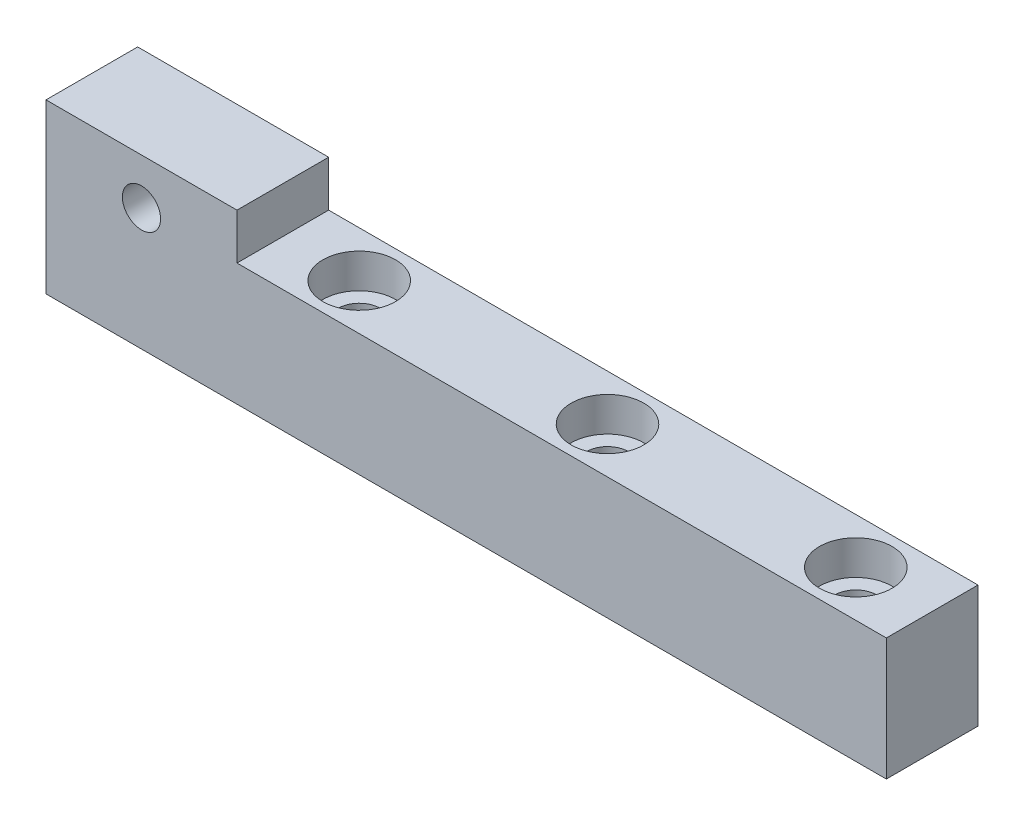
SolidWorks part; units mm, degrees
ref_plane "前视基准面" through (0, 0, 0) normal (0, 0, 1) x (1, 0, 0)
ref_plane "上视基准面" through (0, 0, 0) normal (0, 1, 0) x (1, 0, 0)
ref_plane "右视基准面" through (0, 0, 0) normal (1, 0, 0) x (0, 0, -1)
sketch "草图1" plane through (0, 0, 0) normal (0, 0, 1) x (1, 0, 0)
  line L0 (110, 0) -> (110, 16)
  line L1 (0, 0) -> (0, 22)
  line L2 (25, 16) -> (110, 16)
  line L3 (0, 0) -> (110, 0)
  line L4 (25, 16) -> (25, 22)
  line L5 (0, 22) -> (25, 22)
  circle A0 centre (12.5, 16) radius 2.5
extrude "凸台-拉伸1" add sketch "草图1" along normal blind 12
sketch "草图2" plane through (0, 16, 0) normal (0, 1, 0) x (1, 0, 0)
  circle A0 centre (100, -6) radius 2.75
  circle A1 centre (67.5, -6) radius 2.75
  circle A2 centre (35, -6) radius 2.75
extrude "切除-拉伸1" cut sketch "草图2" against normal through all
sketch "草图3" plane through (0, 16, 0) normal (0, 1, 0) x (1, 0, 0)
  circle A0 centre (100, -6) radius 4.75
  circle A1 centre (67.5, -6) radius 4.75
  circle A2 centre (35, -6) radius 4.75
extrude "切除-拉伸2" cut sketch "草图3" against normal blind 4.5
